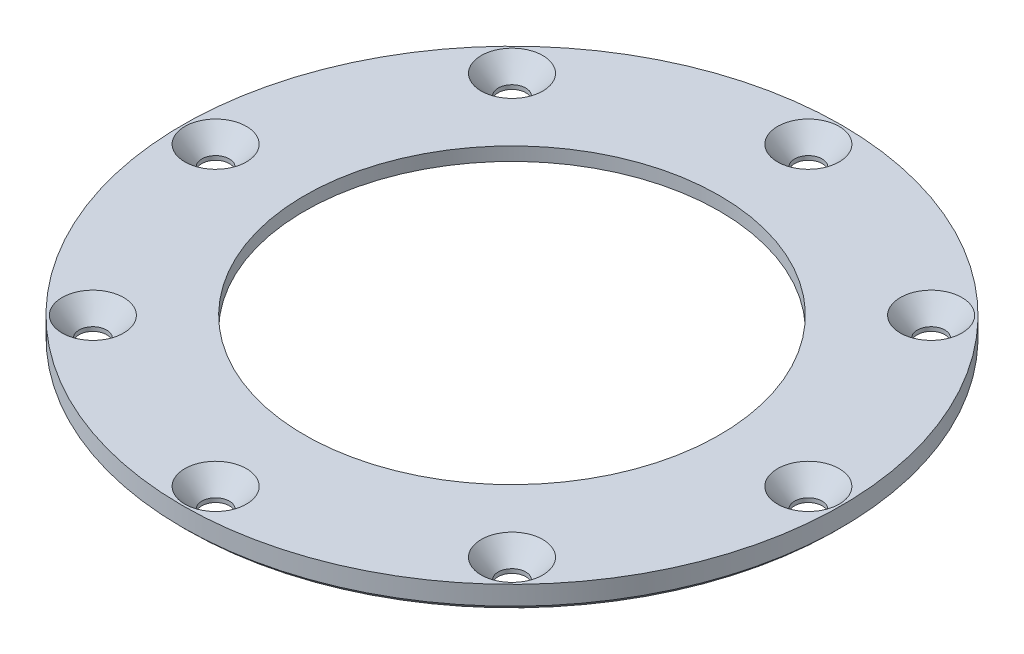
SolidWorks part; units mm, degrees
ref_plane "Front Plane" through (0, 0, 0) normal (0, 0, 1) x (1, 0, 0)
ref_plane "Top Plane" through (0, 0, 0) normal (0, 1, 0) x (1, 0, 0)
ref_plane "Right Plane" through (0, 0, 0) normal (1, 0, 0) x (0, 0, -1)
sketch "Sketch1" plane through (0, 0, 0) normal (0, 0, 1) x (1, 0, 0)
  line L0 (0, 0) -> (0, 104.8616) construction
  line L1 (-24.13, 0) -> (-35.306, 0)
  line L3 (-35.306, 0) -> (-35.306, 2.54)
  line L4 (-35.306, 2.54) -> (-22.225, 2.54)
  line L5 (-22.225, 2.54) -> (-22.225, 1.0999)
  line L6 (-22.225, 1.0999) -> (-24.13, 0)
  dimension "D1" = 44.45
  dimension "D2" = 70.612
  dimension "D3" = 2.54
  dimension "D4" = 48.26
  dimension "D5" = 30
revolve "Revolve1" add sketch "Sketch1" angle 360 about L0
hole_wizard "CSK for #4 Flat Head Machine Screw1" positions "Sketch3" profile "Sketch2" countersink size "#4" standard "ANSI Inch"
sketch "Sketch3" plane through (0, 2.54, 0) normal (0, 1, 0) x (1, 0, 0)
  line L0 (-31.75, 0) -> (0, 0) construction
  circle A0 centre (0, 0) radius 31.75 construction
  circle A2 centre (-31.75, 0) radius 1.1303 construction
  point P0 (-31.75, 0)
sketch "Sketch2" plane through (-31.75, 2.54, 0) normal (1, 0, 0) x (0, 0, 1)
  line L0 (0, 0) -> (0, 3.8849)
  line L1 (0, 3.8849) -> (1.4732, 2.9997)
  line L2 (1.4732, 2.9997) -> (1.4732, 2.1005)
  line L3 (1.4732, 2.1005) -> (3.2991, 0)
  line L5 (3.2991, 0) -> (0, 0)
  line L6 (-1.4732, 2.1005) -> (-3.2991, 0) construction
  line L10 (0, 3.8849) -> (-1.4732, 2.9997) construction
  line L11 (0, -6.35) -> (0, 107.95) construction
  dimension "Hole Dia." = 2.9464
  dimension "Hole Depth" = 2.9997
  dimension "Near C'Sink Dia." = 6.5982
  dimension "Near C'Sink Angle" = 82
  dimension "Drill Angle" = 118
pattern_circular "CirPattern1" count 8 over 360 about axis through (0, 0, 0) along (0, 1, 0) of "CSK for #4 Flat Head Machine Screw1"
chamfer "Chamfer1" distance 0.508 angle 45 1 edges at (0, 0, -35.306)
